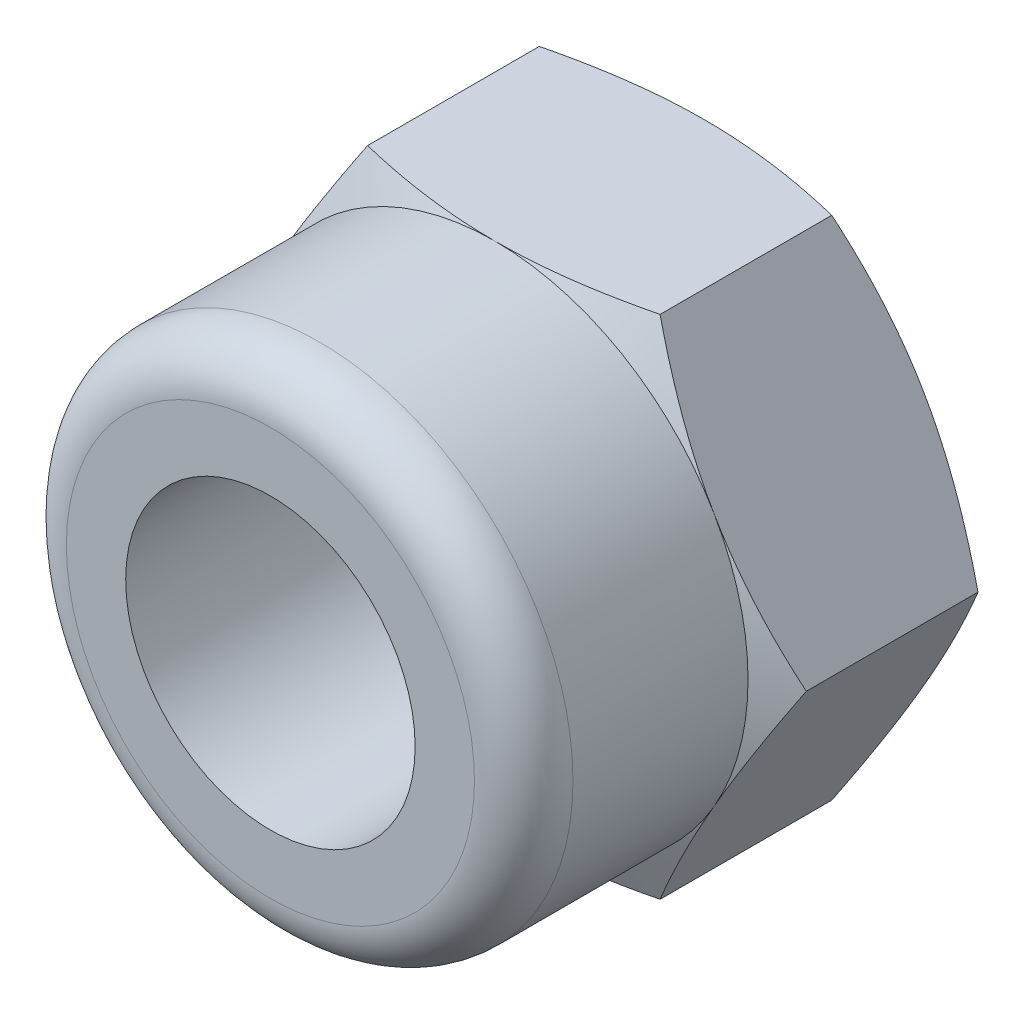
SolidWorks part; units mm, degrees
ref_plane "Plan1" through (0, 0, 0) normal (0, 0, 1) x (1, 0, 0)
ref_plane "Plan2" through (0, 0, 0) normal (0, 1, 0) x (1, 0, 0)
ref_plane "Plan3" through (0, 0, 0) normal (1, 0, 0) x (0, 0, -1)
sketch "Sketch1" plane through (0, 0, 0) normal (0, 0, 1) x (1, 0, 0)
  line L0 (-4.0415, 0) -> (4.0415, 0) construction
  line L1 (0, 3.5) -> (0, -3.5) construction
  line L2 (-2.0207, 3.5) -> (2.0207, 3.5)
  line L3 (2.0207, 3.5) -> (4.0415, 0)
  line L4 (4.0415, 0) -> (2.0207, -3.5)
  line L5 (2.0207, -3.5) -> (-2.0207, -3.5)
  line L6 (-2.0207, -3.5) -> (-4.0415, 0)
  line L7 (-4.0415, 0) -> (-2.0207, 3.5)
  dimension "D1" = 120
  dimension "S" = 7
extrude "Base-Extrude" add sketch "Sketch1" along normal blind 2.9
sketch "Sketch2" plane through (0, 0, 0) normal (0, 1, 0) x (1, 0, 0)
  line L0 (-4.0415, 0) -> (-4.0415, -0.2636)
  line L1 (-4.0415, -2.9) -> (-4.0415, 0) construction
  line L2 (-4.0415, -0.2636) -> (-3.5, 0)
  line L4 (-2.0207, 0) -> (-4.0415, 0) construction
  line L5 (0, 0) -> (0, -2.9) construction
  line L6 (2.0207, -2.9) -> (-2.0207, -2.9) construction
  line L7 (2.0207, 0) -> (-2.0207, 0) construction
  line L8 (-3.5, 0) -> (-4.0415, 0)
  line L9 (-4.0415, -2.9) -> (-4.0415, -2.6364)
  line L10 (-4.0415, -2.6364) -> (-3.5, -2.9)
  line L11 (-2.0207, -2.9) -> (-4.0415, -2.9) construction
  line L12 (-3.5, -2.9) -> (-4.0415, -2.9)
  line L13 (0, 0) -> (0, -0.7) construction
  dimension "D1" = 0.2636
  dimension "P" = 0.7
revolve "Cut-Revolve1" cut sketch "Sketch2" angle 360 about L5
sketch "Sketch3" plane through (0, 0, 0) normal (0, 0, -1) x (-1, 0, 0)
  circle A0 centre (0, 0) radius 3.5
  arc A1 (-3.0311, 1.75) -> (-3.0311, -1.75) centre (0, 0) ccw construction
extrude "Boss-Extrude1" add sketch "Sketch3" against normal blind 6
fillet "Fillet1" radius 0.6805
other "Hole1"
sketch "Sketch4" plane through (0, 0, 0) normal (0, 0, -1) x (-1, 0, 0)
  circle A0 centre (0, 0) radius 1.6211
  arc A1 (-3.0311, 1.75) -> (-3.0311, -1.75) centre (0, 0) ccw construction
  dimension "D1" = 3.2423
chamfer "Chamfer1" distance 0.3789 angle 45
sketch "Esquisse1" plane through (0, 0, 0) normal (0, 0, 1) x (1, 0, 0)
  circle A0 centre (0, 0) radius 2
  dimension "D1" = 4
extrude "DRW" cut sketch "Esquisse1" along normal through all
equation "\"D1@Sketch2\" = \"M@Base-Extrude\" / 11"
equation "\"D1@Fillet1\" = ((\"S@Sketch1\"*1.1547)-\"D@Cosmetic_Thread1\")/6"
equation "\"D1@Sketch4\" = \"D@Cosmetic_Thread1\"-(1.0825*\"P@Sketch2\")"
equation "\"D1@Chamfer1\" = (\"D@Cosmetic_Thread1\"-\"D1@Sketch4\")/2"
